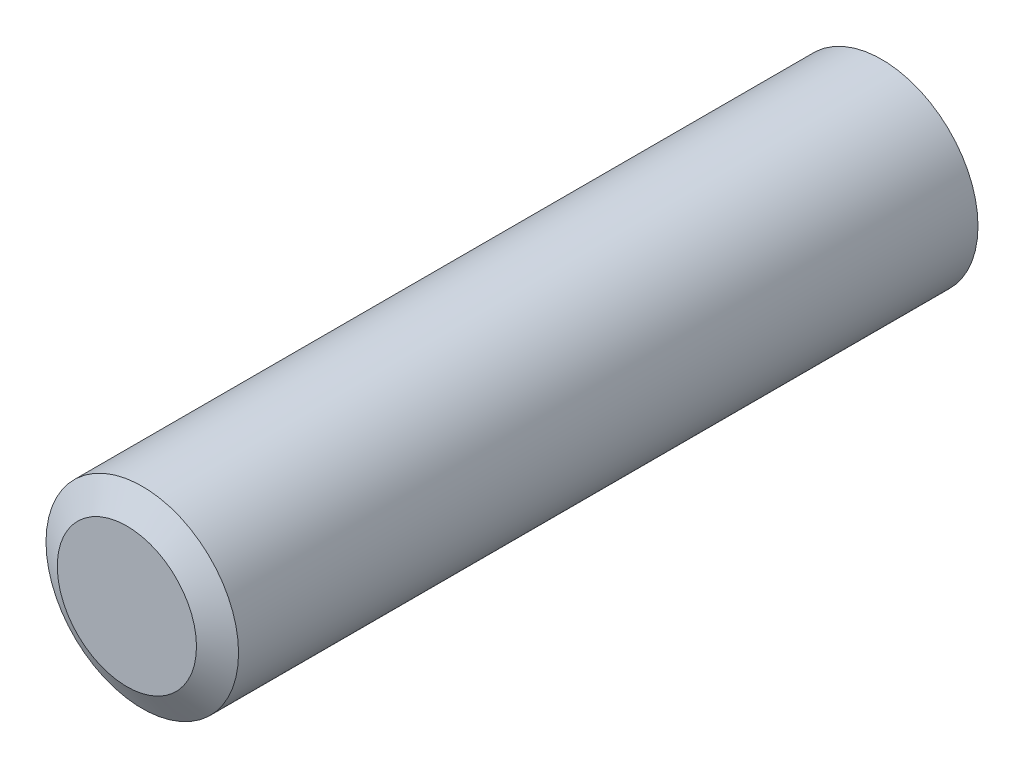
SolidWorks part; units mm, degrees
ref_plane "Front" through (0, 0, 0) normal (0, 0, 1) x (1, 0, 0)
ref_plane "Top" through (0, 0, 0) normal (0, 1, 0) x (1, 0, 0)
ref_plane "Right" through (0, 0, 0) normal (1, 0, 0) x (0, 0, -1)
sketch "Sketch1" plane through (0, 0, 0) normal (0, 0, 1) x (1, 0, 0)
  circle A0 centre (0, 0) radius 3.175
  dimension "D1" = 6.35
extrude "Boss-Extrude1" add sketch "Sketch1" along normal mid plane 25.4
chamfer "Chamfer1" distance 0.508 angle 60 2 edges at (3.175, 0, -12.7) (3.175, 0, 12.7)
equation "\"Buoyancy\"=\"SW-Volume\"*(\"SW-Density\"-.037062)"
